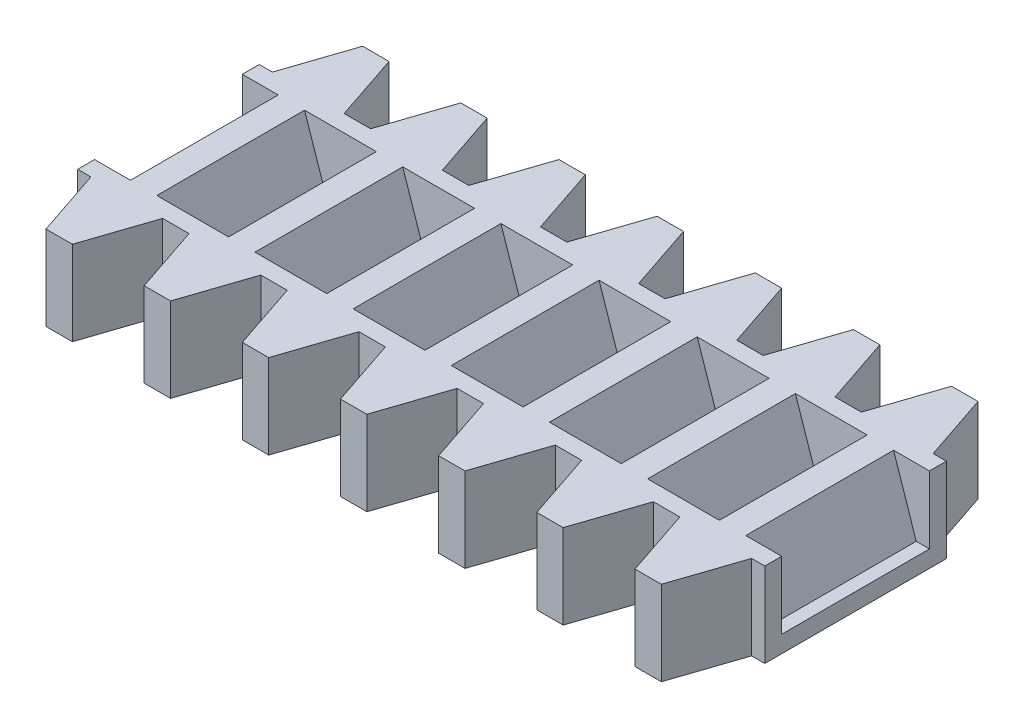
SolidWorks part; units mm, degrees
ref_plane "前视基准面" through (0, 0, 0) normal (0, 0, 1) x (1, 0, 0)
ref_plane "上视基准面" through (0, 0, 0) normal (0, 1, 0) x (1, 0, 0)
ref_plane "右视基准面" through (0, 0, 0) normal (1, 0, 0) x (0, 0, -1)
sketch "草图1" plane through (0, 0, 0) normal (0, 1, 0) x (1, 0, 0)
  line L0 (2.325, -4.3) -> (2.325, 4.3)
  line L1 (2.325, -4.3) -> (-2.325, -4.3)
  line L2 (2.325, 4.3) -> (-2.325, 4.3)
  line L3 (-2.325, -4.3) -> (-2.325, 4.3)
  line L4 (2.325, -4.3) -> (-2.325, 4.3) construction
  line L5 (2.325, 4.3) -> (-2.325, -4.3) construction
  point P1 (0, 0)
  dimension "D1" = 8.6
  dimension "D2" = 4.65
extrude "凸台-拉伸1" add sketch "草图1" along normal blind 4
sketch "草图3" plane through (0, 0, 0) normal (0, 1, 0) x (1, 0, 0)
  line L0 (0, 0) -> (0, 4.3) construction
  line L1 (2.325, 4.3) -> (-2.325, 4.3) construction
  line L2 (0, 4.3) -> (0, 7.5) construction
  line L3 (0.625, 7.5) -> (-0.625, 7.5)
  line L4 (1.7, 4.3) -> (-1.7, 4.3)
  line L5 (-0.625, 7.5) -> (-1.7, 4.3)
  line L6 (0.625, 7.5) -> (1.7, 4.3)
  dimension "D1" = 3.2
  dimension "D2" = 1.7
  dimension "D3" = 0.625
extrude "凸台-拉伸2" add sketch "草图3" along normal blind 4
mirror "镜向1" about plane through (0, 0, 0) normal (0, 0, 1) of "凸台-拉伸2"
sketch "草图4" plane through (0, 0, 0) normal (0, 0, 1) x (1, 0, 0)
  line L0 (0, 0) -> (0, 0.8) construction
  line L1 (0.625, 0) -> (-0.625, 0) construction
  line L2 (0, 0.8) -> (0, 4) construction
  line L3 (0.625, 4) -> (-0.625, 4) construction
  line L4 (0, 4) -> (-0.625, 4) construction
  line L5 (-0.625, 4) -> (-1.7, 4) construction
  line L6 (-0.625, 4) -> (-2.325, 4)
  line L7 (0, 0.8) -> (-1.7, 0.8) construction
  line L8 (-1.7, 0.8) -> (-2.325, 0.8)
  line L9 (-2.325, 4) -> (-2.325, 0) construction
  line L10 (-2.325, 4) -> (-2.325, 0.8)
  line L11 (-0.625, 4) -> (-1.7, 0.8)
  line L12 (1.7, 0.8) -> (2.325, 0.8)
  line L13 (2.325, 4) -> (2.325, 0.8)
  line L14 (0.625, 4) -> (1.7, 0.8)
  line L15 (0.625, 4) -> (2.325, 4)
  dimension "D1" = 0.8
  dimension "D2" = 0.625
  dimension "D3" = 1.7
extrude "切除-拉伸1" cut sketch "草图4" against normal blind 3.5 and the other way blind 3.5
pattern_linear "阵列(线性)4" count 7 spacing 4.65 along (1, 0, 0) of "凸台-拉伸1", "凸台-拉伸2", "镜向1", "切除-拉伸1"
sketch "草图6" plane through (0, 0, 0) normal (1, 0, 0) x (0, 0, -1)
  line L0 (0, 0) -> (0, -2) construction
  line L1 (0, -2) -> (0, -2.5) construction
  line L2 (1.5, 0) -> (0.5, 0)
  line L4 (0.5, 0) -> (0.5, -1.0723)
  line L5 (1.5, 0) -> (1.5, -0.6771)
  line L6 (1.95, -2.5) -> (1.95, -1.5556)
  line L7 (1.1658, -2.5) -> (1.95, -2.5)
  line L8 (0.5, -1.0723) -> (1.1658, -2.5)
  line L9 (-0.5, -1.0723) -> (-1.1658, -2.5)
  line L10 (-1.1658, -2.5) -> (-1.95, -2.5)
  line L11 (-1.95, -2.5) -> (-1.95, -1.5556)
  line L12 (-1.5, 0) -> (-1.5, -0.6771)
  line L13 (-0.5, 0) -> (-0.5, -1.0723)
  line L14 (-1.5, 0) -> (-0.5, 0)
  arc A0 (1.95, -1.5556) -> (1.5, -0.6771) centre (0, -2) ccw
  arc A1 (-1.95, -1.5556) -> (-1.5, -0.6771) centre (0, -2) cw
extrude "凸台-拉伸4" add sketch "草图6" along normal blind 25.9 from offset 1
fillet "圆角1" radius 0.1 8 edges at (13.95, -2.5, 1.95) (26.9, -2.5, 1.5579) (13.95, -2.5, 1.1658) (1, -2.5, 1.5579) (13.95, -2.5, -1.1658) (26.9, -2.5, -1.5579) (13.95, -2.5, -1.95) (1, -2.5, -1.5579)
